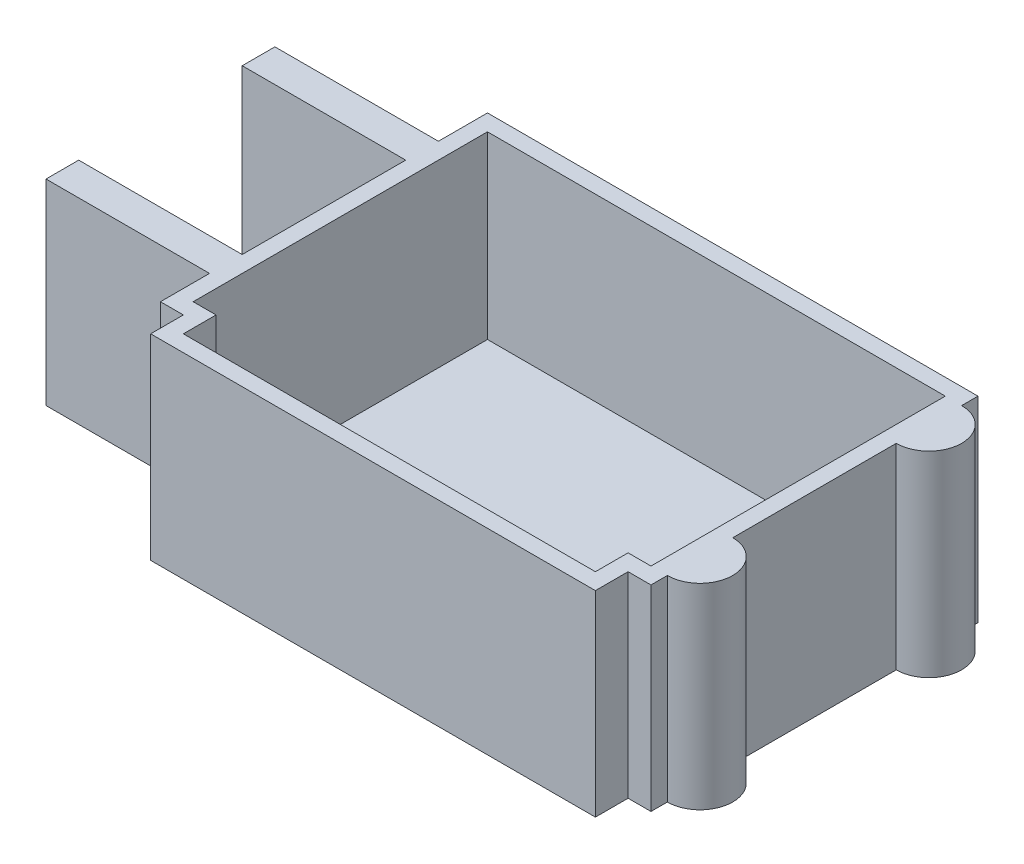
SolidWorks part; units mm, degrees
ref_plane "Front" through (0, 0, 0) normal (0, 0, 1) x (1, 0, 0)
ref_plane "Top" through (0, 0, 0) normal (0, 1, 0) x (1, 0, 0)
ref_plane "Right" through (0, 0, 0) normal (1, 0, 0) x (0, 0, -1)
sketch "Sketch1" plane through (0, 0, 0) normal (0, 1, 0) x (1, 0, 0)
  line L0 (75, -50) -> (-75, 50) construction
  line L1 (-75, 50) -> (75, 50)
  line L2 (-75, 50) -> (-75, 35)
  line L3 (-75, -50) -> (-68, -50)
  line L4 (75, 50) -> (75, 45)
  line L5 (-101.1978, 0) -> (99.8786, 0) construction
  line L6 (-75, 35) -> (-125, 35)
  line L7 (-125, -35) -> (-125, -25)
  line L8 (-75, 25) -> (-125, 25)
  line L9 (-125, 35) -> (-125, 25)
  line L10 (-75, -25) -> (-125, -25)
  line L11 (-75, -35) -> (-125, -35)
  line L12 (-75, -35) -> (-75, -50)
  line L13 (-75, 25) -> (-75, -25)
  line L14 (68, -50) -> (75, -50)
  line L15 (75, 25) -> (75, -25)
  line L16 (-68, -50) -> (-68, -60)
  line L17 (-68, -60) -> (68, -60)
  line L18 (68, -50) -> (68, -60)
  line L19 (75, -45) -> (75, -50)
  arc A0 (75, 45) -> (75, 25) centre (75, 35) cw
  arc A1 (75, -45) -> (75, -25) centre (75, -35) ccw
  dimension "D10" = 10
  dimension "D1" = 150
  dimension "D2" = 100
  dimension "D3" = 10
  dimension "D4" = 15
  dimension "D5" = 50
  dimension "D6" = 7
  dimension "D7" = 7
  dimension "D8" = 10
  dimension "D9" = 15
extrude "Extrude1" add sketch "Sketch1" along normal blind 60
shell "Shell1" thickness 5
